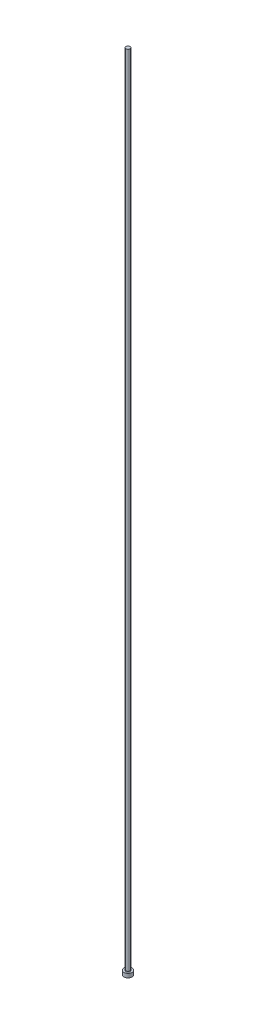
SolidWorks part; units mm, degrees
ref_plane "Plano frontal" through (0, 0, 0) normal (0, 0, 1) x (1, 0, 0)
ref_plane "Plano superior" through (0, 0, 0) normal (0, 1, 0) x (1, 0, 0)
ref_plane "Plano direito" through (0, 0, 0) normal (1, 0, 0) x (0, 0, -1)
sketch "Esboço1" plane through (0, 0, 0) normal (0, 0, 1) x (1, 0, 0)
  line L0 (0, 0) -> (2, 0)
  line L1 (2, 0) -> (2, 2)
  line L2 (2, 2) -> (1.2, 2)
  line L3 (1, 2.2) -> (1, 400)
  line L4 (1, 400) -> (0, 400)
  line L5 (0, 400) -> (0, 0) construction
  line L6 (0, 0) -> (0, 400)
  arc A0 (1.2, 2) -> (1, 2.2) centre (1.2, 2.2) cw
  dimension "D3" = 0.2
  dimension "D1" = 4
  dimension "D2" = 2
  dimension "D4" = 2
  dimension "D5" = 400
revolve "Revolução1" add sketch "Esboço1" angle 360 about L5
sketch "Esboço2"
  dimension "D1" = 1.075
  dimension "D2" = 0.35
  dimension "D3" = 0.225
  dimension "D4" = 0.15
wrap "Envolver1" sketch "Esboço2" wrap type deboss source sketch "Esboço2" thickness 0.1 parameters "D1"=0.1
